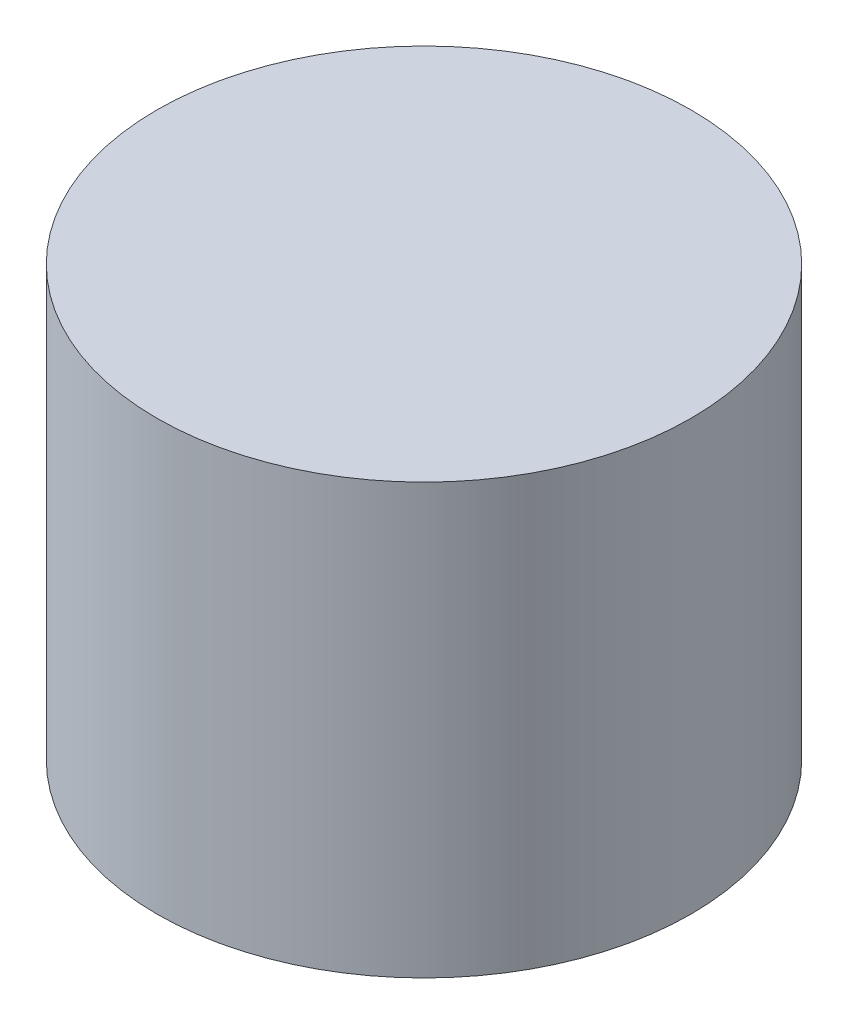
SolidWorks part; units mm, degrees
ref_plane "Front Plane" through (0, 0, 0) normal (0, 0, 1) x (1, 0, 0)
ref_plane "Top Plane" through (0, 0, 0) normal (0, 1, 0) x (1, 0, 0)
ref_plane "Right Plane" through (0, 0, 0) normal (1, 0, 0) x (0, 0, -1)
sketch "Sketch1" plane through (0, 0, 0) normal (0, 1, 0) x (1, 0, 0)
  circle A0 centre (0, 0) radius 12.75
  dimension "D1" = 25.5
extrude "Boss-Extrude1" add sketch "Sketch1" along normal blind 20.5
